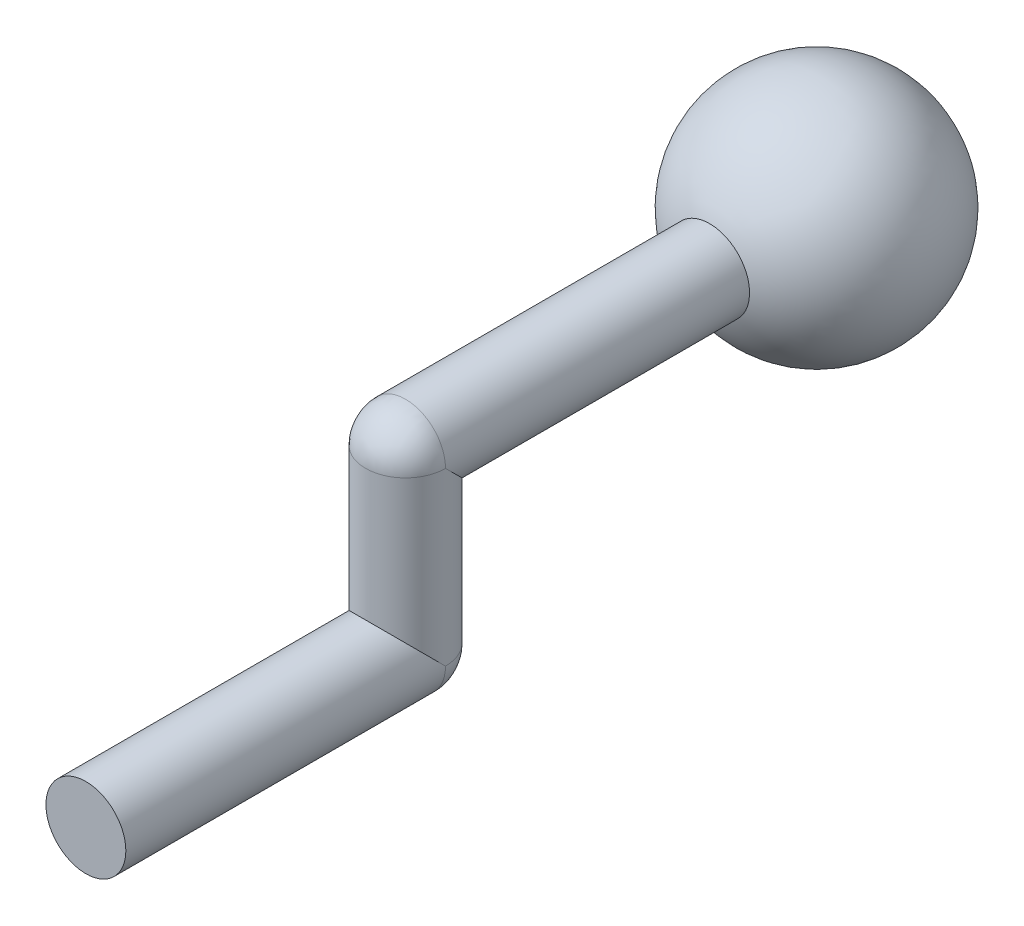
SolidWorks part; units mm, degrees
ref_plane "Face" through (0, 0, 0) normal (0, 0, 1) x (1, 0, 0)
ref_plane "Dessus" through (0, 0, 0) normal (0, 1, 0) x (1, 0, 0)
ref_plane "Droite" through (0, 0, 0) normal (1, 0, 0) x (0, 0, -1)
sketch "Esquisse1" plane through (0, 0, 0) normal (0, 0, 1) x (1, 0, 0)
  circle A0 centre (0, 0) radius 3.5
  dimension "D1" = 7
extrude "Extrusion1" add sketch "Esquisse1" along normal blind 28
sketch "Esquisse2" plane through (0, 0, 0) normal (0, 1, 0) x (1, 0, 0)
  line L0 (3.5, -28) -> (3.5, 0) construction
  circle A0 centre (0, 0) radius 3.5
extrude "Extrusion2" add sketch "Esquisse2" along normal blind 15
sketch "Esquisse3" plane through (0, 0, 0) normal (0, 0, 1) x (1, 0, 0)
  line L0 (3.5, 15) -> (-3.5, 15) construction
  line L1 (3.5, 0) -> (3.5, 15) construction
  circle A0 centre (0, 15) radius 3.5
extrude "Extrusion3" add sketch "Esquisse3" against normal blind 36
sketch "Esquisse4" plane through (0, 0, 0) normal (1, 0, 0) x (0, 0, -1)
  line L0 (36, 8.1654) -> (36, 39.8537) construction
  line L2 (36, 25) -> (36, 5)
  line L3 (36, 11.5) -> (36, 18.5) construction
  arc A0 (36, 5) -> (36, 25) centre (36, 15) ccw
  dimension "D2" = 20
revolve "Révolution2" add sketch "Esquisse4" angle 360 about L0
sketch "Esquisse5" plane through (0, 0, 0) normal (0, 0, 1) x (1, 0, 0)
  line L0 (-12.9566, 15) -> (13.6931, 15) construction
  line L1 (-3.5, 15) -> (3.5, 15)
  line L2 (-3.5, 15) -> (3.5, 15)
  arc A1 (3.5, 15) -> (-3.5, 15) centre (0, 15) ccw
  arc A2 (3.5, 15) -> (-3.5, 15) centre (0, 15) ccw
  dimension "D1" = 0
revolve "Révolution3" add sketch "Esquisse5" angle 360 about L0
sketch "Esquisse6" plane through (0, 0, 0) normal (0, -1, 0) x (1, 0, 0)
  line L0 (9.1238, 0) -> (-10.4409, 0) construction
  line L1 (3.5, 0) -> (-3.5, 0)
  line L2 (3.5, 0) -> (-3.5, 0)
  arc A1 (-3.5, 0) -> (3.5, 0) centre (0, 0) ccw
  arc A2 (-3.5, 0) -> (3.5, 0) centre (0, 0) ccw
  dimension "D1" = 0
revolve "Révolution4" add sketch "Esquisse6" angle 360 about L0
